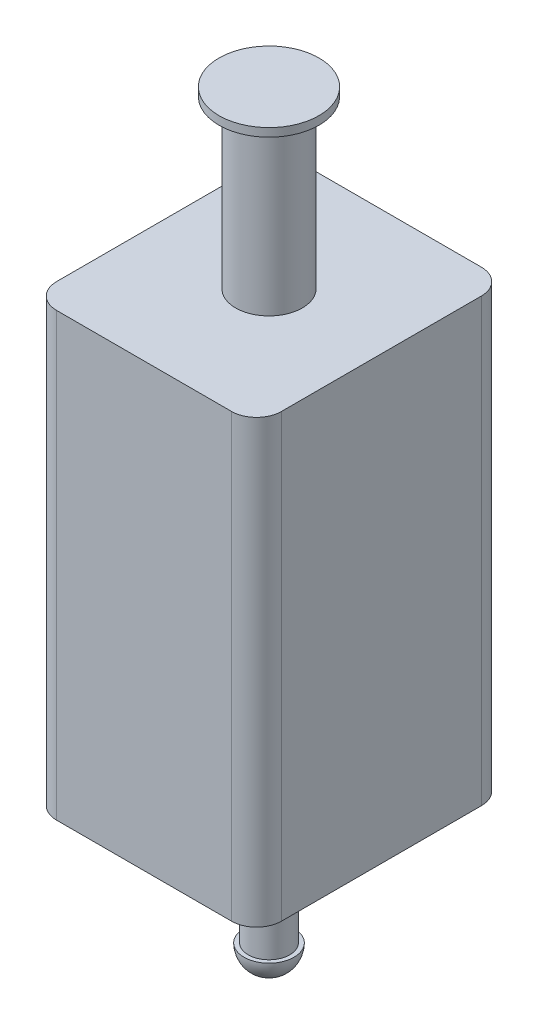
SolidWorks part; units mm, degrees
ref_plane "前视基准面" through (0, 0, 0) normal (0, 0, 1) x (1, 0, 0)
ref_plane "上视基准面" through (0, 0, 0) normal (0, 1, 0) x (1, 0, 0)
ref_plane "右视基准面" through (0, 0, 0) normal (1, 0, 0) x (0, 0, -1)
other "Configuration Table"
sketch "草图1" plane through (0, 0, 0) normal (0, 0, 1) x (1, 0, 0)
  line L1 (-13.5, -26.5) -> (13.5, -26.5)
  line L2 (-13.5, -26.5) -> (-13.5, 26.5)
  line L3 (-13.5, 26.5) -> (13.5, 26.5)
  line L4 (13.5, -26.5) -> (13.5, 26.5)
  line L5 (-13.5, -26.5) -> (13.5, 26.5) construction
  line L6 (-13.5, 26.5) -> (13.5, -26.5) construction
  point P0 (0, 0)
extrude "凸台-拉伸1" add sketch "草图1" along normal blind 30
sketch "草图2" plane through (0, 0, 0) normal (0, 0, -1) x (-1, 0, 0)
  circle A0 centre (-10, -16.5) radius 1.6
  circle A1 centre (10, -16.5) radius 1.6
  circle A2 centre (-10, 13.5) radius 1.6
  circle A3 centre (10, 13.5) radius 1.6
extrude "切除-拉伸1" cut sketch "草图2" against normal blind 6
sketch "草图4" plane through (0, -26.5, 0) normal (0, -1, 0) x (1, 0, 0)
  circle A0 centre (0, 15) radius 2.5
extrude "凸台-拉伸2" add sketch "草图4" along normal blind 15
fillet "圆角1" radius 3 1 edges at (-13.5, 0, 30)
fillet "圆角2" radius 3 3 edges at (-13.5, 0, 0) (13.5, 0, 0) (13.5, 0, 30)
sketch "草图6" plane through (0, 26.5, 0) normal (0, 1, 0) x (1, 0, 0)
  circle A0 centre (0, -15) radius 4
extrude "凸台-拉伸3" add sketch "草图6" along normal blind 20
sketch "草图7" plane through (0, 46.5, 0) normal (0, 1, 0) x (1, 0, 0)
  circle A0 centre (0, -15) radius 6
extrude "凸台-拉伸4" add sketch "草图7" along normal blind 1
sketch "草图10" plane through (0, 0, 0) normal (1, 0, 0) x (0, 0, -1)
  line L0 (-15, -41.5) -> (-15, -44.5)
  line L1 (-17.5, -41.5) -> (-12.5, -41.5) construction
  line L2 (-15, -41.5) -> (-12, -41.5)
  arc A0 (-15, -44.5) -> (-12, -41.5) centre (-15, -41.5) ccw
revolve "旋转1" add sketch "草图10" angle 360 about L0
